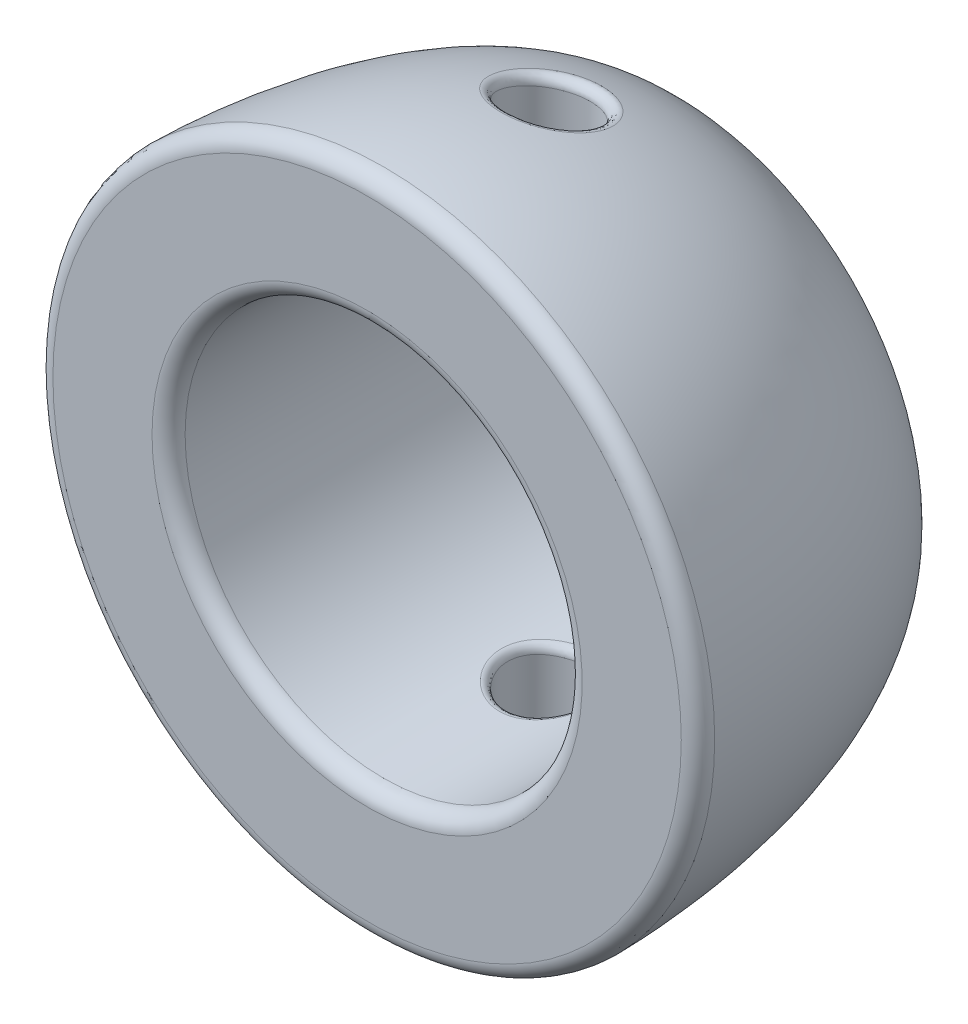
SolidWorks part; units mm, degrees
ref_plane "Спереди" through (0, 0, 0) normal (0, 0, 1) x (1, 0, 0)
ref_plane "Сверху" through (0, 0, 0) normal (0, 1, 0) x (1, 0, 0)
ref_plane "Справа" through (0, 0, 0) normal (1, 0, 0) x (0, 0, -1)
sketch "Эскиз1" plane through (0, 0, 0) normal (1, 0, 0) x (0, 0, -1)
  line L0 (-5, 0) -> (5, 0) construction
  line L1 (-5, 6) -> (5, 6)
  line L2 (-5, 6) -> (-5, 10)
  ellipse E0 centre (-5, 6) end of major axis (5, 6) minor radius 4 (5, 6) -> (-5, 10) ccw
  dimension "D1" = 12
  dimension "D2" = 10
  dimension "D3" = 20
revolve "Повернуть1" add sketch "Эскиз1" angle 360 about L0
fillet "Скругление1" radius 0.5 3 edges at (6, 0, 5) (6, 0, -5) (10, 0, 5)
sketch "Эскиз2" plane through (0, 0, 0) normal (0, 1, 0) x (1, 0, 0)
  circle A0 centre (0, 0.5) radius 1.25
  dimension "D1" = 2.5
  dimension "D2" = 0.5
extrude "Вырез-Вытянуть1" cut sketch "Эскиз2" against normal mid plane 20
fillet "Скругление2" radius 0.25 4 edges at (0.2574, -5.9945, -1.7232) (-0.2574, 5.9945, -1.7232) (0.2798, 8.9585, -1.7183) (-0.2798, -8.9585, -1.7183)
